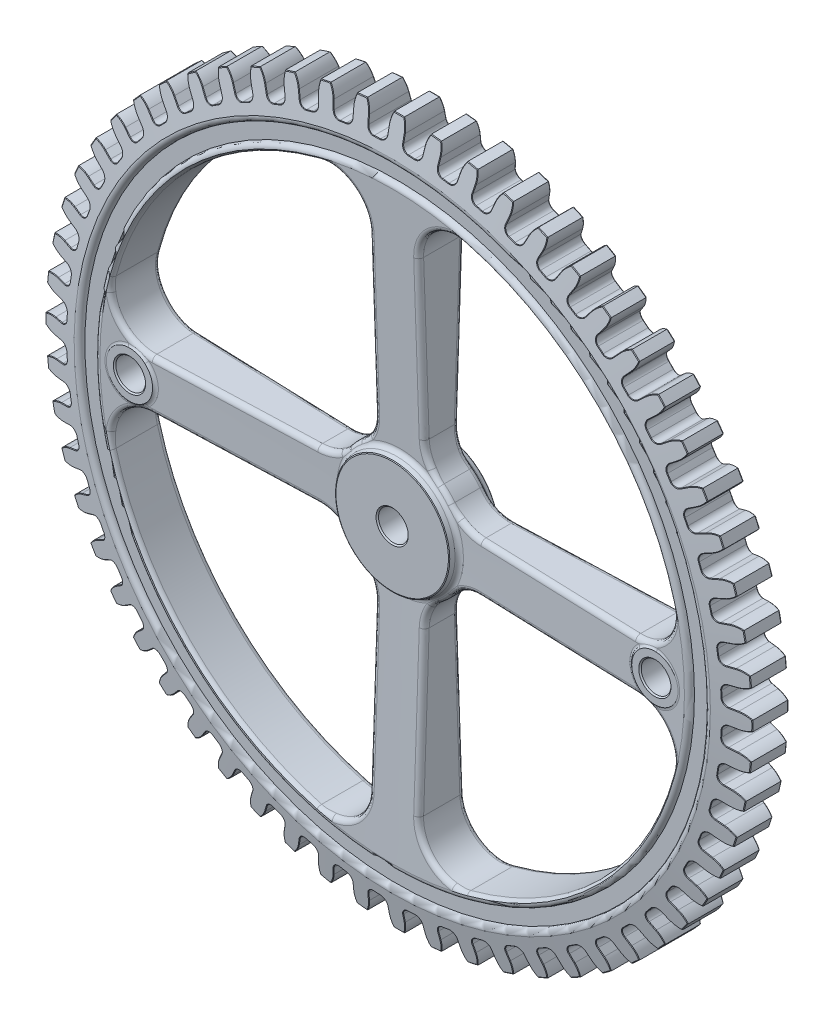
SolidWorks part; units mm, degrees
ref_plane "Спереди" through (0, 0, 0) normal (0, 0, 1) x (1, 0, 0)
ref_plane "Сверху" through (0, 0, 0) normal (0, 1, 0) x (1, 0, 0)
ref_plane "Справа" through (0, 0, 0) normal (1, 0, 0) x (0, 0, -1)
sketch "Эскиз2" plane through (0, 0, 0) normal (1, 0, 0) x (0, 0, -1)
  line L0 (-9.4803, 0) -> (8.8412, 0) construction
  line L1 (5, 3) -> (-5, 3)
  line L2 (5, 3) -> (5, 11.5)
  line L3 (3.6, 71.3) -> (-3.6, 71.3)
  line L4 (0, 0) -> (0, 71.3) construction
  line L5 (4, 63) -> (4, 60)
  line L6 (5, 11.5) -> (5, 38.75) construction
  line L7 (3.6, 71.3) -> (4.9816, 64.1908)
  line L8 (5, 11.5) -> (4.0932, 11.7772)
  line L9 (4.9994, 58.9651) -> (3.3862, 12.7684)
  line L10 (-5, 3) -> (-5, 11.5)
  line L11 (-5, 11.5) -> (-4.0932, 11.7772)
  line L12 (-4.9994, 58.9651) -> (-3.3862, 12.7684)
  line L13 (-4, 63) -> (-4, 60)
  line L14 (-3.6, 71.3) -> (-4.9816, 64.1908)
  arc A0 (4, 63) -> (4.9816, 64.1908) centre (4, 64) ccw
  arc A1 (4.9994, 58.9651) -> (4, 60) centre (4, 59) ccw
  arc A2 (3.3862, 12.7684) -> (4.0932, 11.7772) centre (4.3856, 12.7335) ccw
  arc A3 (-3.3862, 12.7684) -> (-4.0932, 11.7772) centre (-4.3856, 12.7335) cw
  arc A4 (-4.9994, 58.9651) -> (-4, 60) centre (-4, 59) cw
  arc A5 (-4, 63) -> (-4.9816, 64.1908) centre (-4, 64) cw
  point P19 (0, 3)
  dimension "D8" = 2
  dimension "D1" = 8.3
  dimension "D2" = 71.3
  dimension "D3" = 5
  dimension "D4" = 3
  dimension "D5" = 3.6
  dimension "D6" = 3
  dimension "D7" = 11.5
  dimension "D9" = 4
  dimension "D10" = 17
  dimension "D11" = 2
revolve "Повернуть1" add sketch "Эскиз2" angle 360 about L0
sketch "Эскиз4" plane through (0, 0, 0) normal (0, 0, 1) x (1, 0, 0)
  line L0 (0, 77.9843) -> (0, -81.6368) construction
  line L1 (-86.0797, 0) -> (81.9993, 0) construction
  line L2 (5, 48.7981) -> (5, 16.4924)
  line L3 (16.4924, 5) -> (48.7981, 5)
  line L4 (48.7981, -5) -> (16.4924, -5)
  line L5 (5, -16.4924) -> (5, -48.7981)
  line L6 (-5, -48.7981) -> (-5, -16.4924)
  line L7 (-16.4924, -5) -> (-48.7981, -5)
  line L8 (-48.7981, 5) -> (-16.4924, 5)
  line L9 (-5, 16.4924) -> (-5, 48.7981)
  arc A0 (10.2096, 8.0476) -> (8.0476, 10.2096) centre (0, 0) ccw
  arc A1 (56.5284, 15.0594) -> (15.0594, 56.5284) centre (0, 0) ccw
  arc A2 (15.0594, 56.5284) -> (5, 48.7981) centre (13, 48.7981) ccw
  arc A3 (48.7981, 5) -> (56.5284, 15.0594) centre (48.7981, 13) ccw
  arc A4 (5, 16.4924) -> (8.0476, 10.2096) centre (13, 16.4924) ccw
  arc A5 (10.2096, 8.0476) -> (16.4924, 5) centre (16.4924, 13) ccw
  arc A6 (8.0476, -10.2096) -> (10.2096, -8.0476) centre (0, 0) ccw
  arc A7 (15.0594, -56.5284) -> (56.5284, -15.0594) centre (0, 0) ccw
  arc A8 (56.5284, -15.0594) -> (48.7981, -5) centre (48.7981, -13) ccw
  arc A9 (5, -48.7981) -> (15.0594, -56.5284) centre (13, -48.7981) ccw
  arc A10 (16.4924, -5) -> (10.2096, -8.0476) centre (16.4924, -13) ccw
  arc A11 (8.0476, -10.2096) -> (5, -16.4924) centre (13, -16.4924) ccw
  arc A12 (-10.2096, -8.0476) -> (-8.0476, -10.2096) centre (0, 0) ccw
  arc A13 (-56.5284, -15.0594) -> (-15.0594, -56.5284) centre (0, 0) ccw
  arc A14 (-15.0594, -56.5284) -> (-5, -48.7981) centre (-13, -48.7981) ccw
  arc A15 (-48.7981, -5) -> (-56.5284, -15.0594) centre (-48.7981, -13) ccw
  arc A16 (-5, -16.4924) -> (-8.0476, -10.2096) centre (-13, -16.4924) ccw
  arc A17 (-10.2096, -8.0476) -> (-16.4924, -5) centre (-16.4924, -13) ccw
  arc A18 (-8.0476, 10.2096) -> (-10.2096, 8.0476) centre (0, 0) ccw
  arc A19 (-15.0594, 56.5284) -> (-56.5284, 15.0594) centre (0, 0) ccw
  arc A20 (-56.5284, 15.0594) -> (-48.7981, 5) centre (-48.7981, 13) ccw
  arc A21 (-5, 48.7981) -> (-15.0594, 56.5284) centre (-13, 48.7981) ccw
  arc A22 (-16.4924, 5) -> (-10.2096, 8.0476) centre (-16.4924, 13) ccw
  arc A23 (-8.0476, 10.2096) -> (-5, 16.4924) centre (-13, 16.4924) ccw
  dimension "D3" = 26
  dimension "D4" = 117
  dimension "D5" = 16
  dimension "D1" = 5
  dimension "D2" = 5
  dimension "D7" = 10
  dimension "D6" = 4
extrude "Вырез-Вытянуть1" cut sketch "Эскиз4" against normal mid plane 10
fillet "Скругление1" radius 1 56 edges at (12.2001, 6.249, -3.419) (9.1924, 9.1924, -3.3943) (5.4509, 13.8447, -3.4599) (7.5393, 54.6445, -4.8666) (55.5841, 8.7633, -4.9053) (54.6445, -7.5393, -4.8666) (8.7633, -55.5841, -4.9053) (6.249, -12.2001, -3.419) (9.1924, -9.1924, -3.3943) (13.8447, -5.4509, -3.4599) (-12.2001, -6.249, -3.419) (-9.1924, -9.1924, -3.3943) (-5.4509, -13.8447, -3.4599) (-7.5393, -54.6445, -4.8666) (-55.5841, -8.7633, -4.9053) (-54.6445, 7.5393, -4.8666) (-8.7633, 55.5841, -4.9053) (-6.249, 12.2001, -3.419) (-9.1924, 9.1924, -3.3943) (-13.8447, 5.4509, -3.4599) (7.5393, -54.6445, 4.8666) (55.5841, -8.7633, 4.9053) (12.2001, -6.249, 3.419) (9.1924, -9.1924, 3.3943) (5.4509, -13.8447, 3.4599) (-54.6445, -7.5393, 4.8666) (-8.7633, -55.5841, 4.9053) (-6.249, -12.2001, 3.419) (-9.1924, -9.1924, 3.3943) (-13.8447, -5.4509, 3.4599) (-7.5393, 54.6445, 4.8666) (-55.5841, 8.7633, 4.9053) (-12.2001, 6.249, 3.419) (-9.1924, 9.1924, 3.3943) (-5.4509, 13.8447, 3.4599) (6.249, 12.2001, 3.419) (9.1924, 9.1924, 3.3943) (13.8447, 5.4509, 3.4599) (54.6445, 7.5393, 4.8666) (8.7633, 55.5841, 4.9053)
sketch "Эскиз5" plane through (0, 0, 0) normal (0, 0, 1) x (1, 0, 0)
  line L0 (0, 93.6984) -> (0, 0) construction
  line L1 (0, 0) -> (3.6112, 68.9054) construction
  line L2 (-1.6, 68.9054) -> (-1.6, 67.3339)
  line L3 (1.6, 68.9054) -> (1.6, 67.3339)
  line L4 (5.6113, 68.6952) -> (5.4471, 67.1322)
  line L5 (8.7938, 68.3607) -> (8.6295, 66.7978)
  line L6 (12.7612, 67.7323) -> (12.4345, 66.1951)
  line L7 (15.8913, 67.067) -> (15.5645, 65.5298)
  line L8 (19.7713, 66.0274) -> (19.2856, 64.5327)
  line L9 (22.8146, 65.0385) -> (22.329, 63.5439)
  line L10 (26.5647, 63.599) -> (25.9255, 62.1633)
  line L11 (29.488, 62.2975) -> (28.8488, 60.8618)
  line L12 (33.0671, 60.4739) -> (32.2813, 59.1128)
  line L13 (35.8384, 58.8739) -> (35.0526, 57.5128)
  line L14 (39.2072, 56.6861) -> (38.2834, 55.4147)
  line L15 (41.796, 54.8052) -> (40.8723, 53.5338)
  line L16 (44.9177, 52.2773) -> (43.8661, 51.1094)
  line L17 (47.2958, 50.1361) -> (46.2442, 48.9682)
  line L18 (50.1361, 47.2958) -> (48.9682, 46.2442)
  line L19 (52.2773, 44.9177) -> (51.1094, 43.8661)
  line L20 (54.8052, 41.796) -> (53.5338, 40.8723)
  line L21 (56.6861, 39.2072) -> (55.4147, 38.2834)
  line L22 (58.8739, 35.8384) -> (57.5128, 35.0526)
  line L23 (60.4739, 33.0671) -> (59.1128, 32.2813)
  line L24 (62.2975, 29.488) -> (60.8618, 28.8488)
  line L25 (63.599, 26.5647) -> (62.1633, 25.9255)
  line L26 (65.0385, 22.8146) -> (63.5439, 22.329)
  line L27 (66.0274, 19.7713) -> (64.5327, 19.2856)
  line L28 (67.067, 15.8913) -> (65.5298, 15.5645)
  line L29 (67.7323, 12.7612) -> (66.1951, 12.4345)
  line L30 (68.3607, 8.7938) -> (66.7978, 8.6295)
  line L31 (68.6952, 5.6113) -> (67.1322, 5.4471)
  line L32 (68.9054, 1.6) -> (67.3339, 1.6)
  line L33 (68.9054, -1.6) -> (67.3339, -1.6)
  line L34 (68.6952, -5.6113) -> (67.1322, -5.4471)
  line L35 (68.3607, -8.7938) -> (66.7978, -8.6295)
  line L36 (67.7323, -12.7612) -> (66.1951, -12.4345)
  line L37 (67.067, -15.8913) -> (65.5298, -15.5645)
  line L38 (66.0274, -19.7713) -> (64.5327, -19.2856)
  line L39 (65.0385, -22.8146) -> (63.5439, -22.329)
  line L40 (63.599, -26.5647) -> (62.1633, -25.9255)
  line L41 (62.2975, -29.488) -> (60.8618, -28.8488)
  line L42 (60.4739, -33.0671) -> (59.1128, -32.2813)
  line L43 (58.8739, -35.8384) -> (57.5128, -35.0526)
  line L44 (56.6861, -39.2072) -> (55.4147, -38.2834)
  line L45 (54.8052, -41.796) -> (53.5338, -40.8723)
  line L46 (52.2773, -44.9177) -> (51.1094, -43.8661)
  line L47 (50.1361, -47.2958) -> (48.9682, -46.2442)
  line L48 (47.2958, -50.1361) -> (46.2442, -48.9682)
  line L49 (44.9177, -52.2773) -> (43.8661, -51.1094)
  line L50 (41.796, -54.8052) -> (40.8723, -53.5338)
  line L51 (39.2072, -56.6861) -> (38.2834, -55.4147)
  line L52 (35.8384, -58.8739) -> (35.0526, -57.5128)
  line L53 (33.0671, -60.4739) -> (32.2813, -59.1128)
  line L54 (29.488, -62.2975) -> (28.8488, -60.8618)
  line L55 (26.5647, -63.599) -> (25.9255, -62.1633)
  line L56 (22.8146, -65.0385) -> (22.329, -63.5439)
  line L57 (19.7713, -66.0274) -> (19.2856, -64.5327)
  line L58 (15.8913, -67.067) -> (15.5645, -65.5298)
  line L59 (12.7612, -67.7323) -> (12.4345, -66.1951)
  line L60 (8.7938, -68.3607) -> (8.6295, -66.7978)
  line L61 (5.6113, -68.6952) -> (5.4471, -67.1322)
  line L62 (1.6, -68.9054) -> (1.6, -67.3339)
  line L63 (-1.6, -68.9054) -> (-1.6, -67.3339)
  line L64 (-5.6113, -68.6952) -> (-5.4471, -67.1322)
  line L65 (-8.7938, -68.3607) -> (-8.6295, -66.7978)
  line L66 (-12.7612, -67.7323) -> (-12.4345, -66.1951)
  line L67 (-15.8913, -67.067) -> (-15.5645, -65.5298)
  line L68 (-19.7713, -66.0274) -> (-19.2856, -64.5327)
  line L69 (-22.8146, -65.0385) -> (-22.329, -63.5439)
  line L70 (-26.5647, -63.599) -> (-25.9255, -62.1633)
  line L71 (-29.488, -62.2975) -> (-28.8488, -60.8618)
  line L72 (-33.0671, -60.4739) -> (-32.2813, -59.1128)
  line L73 (-35.8384, -58.8739) -> (-35.0526, -57.5128)
  line L74 (-39.2072, -56.6861) -> (-38.2834, -55.4147)
  line L75 (-41.796, -54.8052) -> (-40.8723, -53.5338)
  line L76 (-44.9177, -52.2773) -> (-43.8661, -51.1094)
  line L77 (-47.2958, -50.1361) -> (-46.2442, -48.9682)
  line L78 (-50.1361, -47.2958) -> (-48.9682, -46.2442)
  line L79 (-52.2773, -44.9177) -> (-51.1094, -43.8661)
  line L80 (-54.8052, -41.796) -> (-53.5338, -40.8723)
  line L81 (-56.6861, -39.2072) -> (-55.4147, -38.2834)
  line L82 (-58.8739, -35.8384) -> (-57.5128, -35.0526)
  line L83 (-60.4739, -33.0671) -> (-59.1128, -32.2813)
  line L84 (-62.2975, -29.488) -> (-60.8618, -28.8488)
  line L85 (-63.599, -26.5647) -> (-62.1633, -25.9255)
  line L86 (-65.0385, -22.8146) -> (-63.5439, -22.329)
  line L87 (-66.0274, -19.7713) -> (-64.5327, -19.2856)
  line L88 (-67.067, -15.8913) -> (-65.5298, -15.5645)
  line L89 (-67.7323, -12.7612) -> (-66.1951, -12.4345)
  line L90 (-68.3607, -8.7938) -> (-66.7978, -8.6295)
  line L91 (-68.6952, -5.6113) -> (-67.1322, -5.4471)
  line L92 (-68.9054, -1.6) -> (-67.3339, -1.6)
  line L93 (-68.9054, 1.6) -> (-67.3339, 1.6)
  line L94 (-68.6952, 5.6113) -> (-67.1322, 5.4471)
  line L95 (-68.3607, 8.7938) -> (-66.7978, 8.6295)
  line L96 (-67.7323, 12.7612) -> (-66.1951, 12.4345)
  line L97 (-67.067, 15.8913) -> (-65.5298, 15.5645)
  line L98 (-66.0274, 19.7713) -> (-64.5327, 19.2856)
  line L99 (-65.0385, 22.8146) -> (-63.5439, 22.329)
  line L100 (-63.599, 26.5647) -> (-62.1633, 25.9255)
  line L101 (-62.2975, 29.488) -> (-60.8618, 28.8488)
  line L102 (-60.4739, 33.0671) -> (-59.1128, 32.2813)
  line L103 (-58.8739, 35.8384) -> (-57.5128, 35.0526)
  line L104 (-56.6861, 39.2072) -> (-55.4147, 38.2834)
  line L105 (-54.8052, 41.796) -> (-53.5338, 40.8723)
  line L106 (-52.2773, 44.9177) -> (-51.1094, 43.8661)
  line L107 (-50.1361, 47.2958) -> (-48.9682, 46.2442)
  line L108 (-47.2958, 50.1361) -> (-46.2442, 48.9682)
  line L109 (-44.9177, 52.2773) -> (-43.8661, 51.1094)
  line L110 (-41.796, 54.8052) -> (-40.8723, 53.5338)
  line L111 (-39.2072, 56.6861) -> (-38.2834, 55.4147)
  line L112 (-35.8384, 58.8739) -> (-35.0526, 57.5128)
  line L113 (-33.0671, 60.4739) -> (-32.2813, 59.1128)
  line L114 (-29.488, 62.2975) -> (-28.8488, 60.8618)
  line L115 (-26.5647, 63.599) -> (-25.9255, 62.1633)
  line L116 (-22.8146, 65.0385) -> (-22.329, 63.5439)
  line L117 (-19.7713, 66.0274) -> (-19.2856, 64.5327)
  line L118 (-15.8913, 67.067) -> (-15.5645, 65.5298)
  line L119 (-12.7612, 67.7323) -> (-12.4345, 66.1951)
  line L120 (-8.7938, 68.3607) -> (-8.6295, 66.7978)
  line L121 (-5.6113, 68.6952) -> (-5.4471, 67.1322)
  circle A0 centre (0, 0) radius 69 construction
  arc A1 (-9.7062, 65.4088) -> (-10.9813, 65.2068) centre (0, 0) ccw
  arc A2 (-1.021, 71.2927) -> (-1.6, 68.9054) centre (3.6112, 68.9054) ccw
  circle A3 centre (0, 0) radius 71.3 construction
  arc A4 (1.021, 71.2927) -> (-1.021, 71.2927) centre (0, 0) ccw
  arc A5 (1.021, 71.2927) -> (1.6, 68.9054) centre (-3.6112, 68.9054) cw
  arc A6 (6.4367, 71.0089) -> (5.6113, 68.6952) centre (10.794, 68.1505) ccw
  arc A7 (8.4676, 70.7954) -> (6.4367, 71.0089) centre (0, 0) ccw
  arc A8 (8.4676, 70.7954) -> (8.7938, 68.3607) centre (3.6112, 68.9054) cw
  arc A9 (13.8239, 69.9471) -> (12.7612, 67.7323) centre (17.8585, 66.6489) ccw
  arc A10 (15.8213, 69.5225) -> (13.8239, 69.9471) centre (0, 0) ccw
  arc A11 (15.8213, 69.5225) -> (15.8913, 67.067) centre (10.794, 68.1505) cw
  arc A12 (21.0596, 68.1189) -> (19.7713, 66.0274) centre (24.7274, 64.417) ccw
  arc A13 (23.0017, 67.4879) -> (21.0596, 68.1189) centre (0, 0) ccw
  arc A14 (23.0017, 67.4879) -> (22.8146, 65.0385) centre (17.8585, 66.6489) cw
  arc A15 (28.0646, 65.5444) -> (26.5647, 63.599) centre (31.3253, 61.4795) ccw
  arc A16 (29.9301, 64.7138) -> (28.0646, 65.5444) centre (0, 0) ccw
  arc A17 (29.9301, 64.7138) -> (29.488, 62.2975) centre (24.7274, 64.417) cw
  arc A18 (34.7621, 62.2518) -> (33.0671, 60.4739) centre (37.5801, 57.8683) ccw
  arc A19 (36.5306, 61.2308) -> (34.7621, 62.2518) centre (0, 0) ccw
  arc A20 (36.5306, 61.2308) -> (35.8384, 58.8739) centre (31.3253, 61.4795) cw
  arc A21 (41.0788, 58.2771) -> (39.2072, 56.6861) centre (43.4231, 53.6231) ccw
  arc A22 (42.7308, 57.0768) -> (41.0788, 58.2771) centre (0, 0) ccw
  arc A23 (42.7308, 57.0768) -> (41.796, 54.8052) centre (37.5801, 57.8683) cw
  arc A24 (46.9453, 53.664) -> (44.9177, 52.2773) centre (48.7904, 48.7904) ccw
  arc A25 (48.4629, 52.2976) -> (46.9453, 53.664) centre (0, 0) ccw
  arc A26 (48.4629, 52.2976) -> (47.2958, 50.1361) centre (43.4231, 53.6231) cw
  arc A27 (52.2976, 48.4629) -> (50.1361, 47.2958) centre (53.6231, 43.4231) ccw
  arc A28 (53.664, 46.9453) -> (52.2976, 48.4629) centre (0, 0) ccw
  arc A29 (53.664, 46.9453) -> (52.2773, 44.9177) centre (48.7904, 48.7904) cw
  arc A30 (57.0768, 42.7308) -> (54.8052, 41.796) centre (57.8683, 37.5801) ccw
  arc A31 (58.2771, 41.0788) -> (57.0768, 42.7308) centre (0, 0) ccw
  arc A32 (58.2771, 41.0788) -> (56.6861, 39.2072) centre (53.6231, 43.4231) cw
  arc A33 (61.2308, 36.5306) -> (58.8739, 35.8384) centre (61.4795, 31.3253) ccw
  arc A34 (62.2518, 34.7621) -> (61.2308, 36.5306) centre (0, 0) ccw
  arc A35 (62.2518, 34.7621) -> (60.4739, 33.0671) centre (57.8683, 37.5801) cw
  arc A36 (64.7138, 29.9301) -> (62.2975, 29.488) centre (64.417, 24.7274) ccw
  arc A37 (65.5444, 28.0646) -> (64.7138, 29.9301) centre (0, 0) ccw
  arc A38 (65.5444, 28.0646) -> (63.599, 26.5647) centre (61.4795, 31.3253) cw
  arc A39 (67.4879, 23.0017) -> (65.0385, 22.8146) centre (66.6489, 17.8585) ccw
  arc A40 (68.1189, 21.0596) -> (67.4879, 23.0017) centre (0, 0) ccw
  arc A41 (68.1189, 21.0596) -> (66.0274, 19.7713) centre (64.417, 24.7274) cw
  arc A42 (69.5225, 15.8213) -> (67.067, 15.8913) centre (68.1505, 10.794) ccw
  arc A43 (69.9471, 13.8239) -> (69.5225, 15.8213) centre (0, 0) ccw
  arc A44 (69.9471, 13.8239) -> (67.7323, 12.7612) centre (66.6489, 17.8585) cw
  arc A45 (70.7954, 8.4676) -> (68.3607, 8.7938) centre (68.9054, 3.6112) ccw
  arc A46 (71.0089, 6.4367) -> (70.7954, 8.4676) centre (0, 0) ccw
  arc A47 (71.0089, 6.4367) -> (68.6952, 5.6113) centre (68.1505, 10.794) cw
  arc A48 (71.2927, 1.021) -> (68.9054, 1.6) centre (68.9054, -3.6112) ccw
  arc A49 (71.2927, -1.021) -> (71.2927, 1.021) centre (0, 0) ccw
  arc A50 (71.2927, -1.021) -> (68.9054, -1.6) centre (68.9054, 3.6112) cw
  arc A51 (71.0089, -6.4367) -> (68.6952, -5.6113) centre (68.1505, -10.794) ccw
  arc A52 (70.7954, -8.4676) -> (71.0089, -6.4367) centre (0, 0) ccw
  arc A53 (70.7954, -8.4676) -> (68.3607, -8.7938) centre (68.9054, -3.6112) cw
  arc A54 (69.9471, -13.8239) -> (67.7323, -12.7612) centre (66.6489, -17.8585) ccw
  arc A55 (69.5225, -15.8213) -> (69.9471, -13.8239) centre (0, 0) ccw
  arc A56 (69.5225, -15.8213) -> (67.067, -15.8913) centre (68.1505, -10.794) cw
  arc A57 (68.1189, -21.0596) -> (66.0274, -19.7713) centre (64.417, -24.7274) ccw
  arc A58 (67.4879, -23.0017) -> (68.1189, -21.0596) centre (0, 0) ccw
  arc A59 (67.4879, -23.0017) -> (65.0385, -22.8146) centre (66.6489, -17.8585) cw
  arc A60 (65.5444, -28.0646) -> (63.599, -26.5647) centre (61.4795, -31.3253) ccw
  arc A61 (64.7138, -29.9301) -> (65.5444, -28.0646) centre (0, 0) ccw
  arc A62 (64.7138, -29.9301) -> (62.2975, -29.488) centre (64.417, -24.7274) cw
  arc A63 (62.2518, -34.7621) -> (60.4739, -33.0671) centre (57.8683, -37.5801) ccw
  arc A64 (61.2308, -36.5306) -> (62.2518, -34.7621) centre (0, 0) ccw
  arc A65 (61.2308, -36.5306) -> (58.8739, -35.8384) centre (61.4795, -31.3253) cw
  arc A66 (58.2771, -41.0788) -> (56.6861, -39.2072) centre (53.6231, -43.4231) ccw
  arc A67 (57.0768, -42.7308) -> (58.2771, -41.0788) centre (0, 0) ccw
  arc A68 (57.0768, -42.7308) -> (54.8052, -41.796) centre (57.8683, -37.5801) cw
  arc A69 (53.664, -46.9453) -> (52.2773, -44.9177) centre (48.7904, -48.7904) ccw
  arc A70 (52.2976, -48.4629) -> (53.664, -46.9453) centre (0, 0) ccw
  arc A71 (52.2976, -48.4629) -> (50.1361, -47.2958) centre (53.6231, -43.4231) cw
  arc A72 (48.4629, -52.2976) -> (47.2958, -50.1361) centre (43.4231, -53.6231) ccw
  arc A73 (46.9453, -53.664) -> (48.4629, -52.2976) centre (0, 0) ccw
  arc A74 (46.9453, -53.664) -> (44.9177, -52.2773) centre (48.7904, -48.7904) cw
  arc A75 (42.7308, -57.0768) -> (41.796, -54.8052) centre (37.5801, -57.8683) ccw
  arc A76 (41.0788, -58.2771) -> (42.7308, -57.0768) centre (0, 0) ccw
  arc A77 (41.0788, -58.2771) -> (39.2072, -56.6861) centre (43.4231, -53.6231) cw
  arc A78 (36.5306, -61.2308) -> (35.8384, -58.8739) centre (31.3253, -61.4795) ccw
  arc A79 (34.7621, -62.2518) -> (36.5306, -61.2308) centre (0, 0) ccw
  arc A80 (34.7621, -62.2518) -> (33.0671, -60.4739) centre (37.5801, -57.8683) cw
  arc A81 (29.9301, -64.7138) -> (29.488, -62.2975) centre (24.7274, -64.417) ccw
  arc A82 (28.0646, -65.5444) -> (29.9301, -64.7138) centre (0, 0) ccw
  arc A83 (28.0646, -65.5444) -> (26.5647, -63.599) centre (31.3253, -61.4795) cw
  arc A84 (23.0017, -67.4879) -> (22.8146, -65.0385) centre (17.8585, -66.6489) ccw
  arc A85 (21.0596, -68.1189) -> (23.0017, -67.4879) centre (0, 0) ccw
  arc A86 (21.0596, -68.1189) -> (19.7713, -66.0274) centre (24.7274, -64.417) cw
  arc A87 (15.8213, -69.5225) -> (15.8913, -67.067) centre (10.794, -68.1505) ccw
  arc A88 (13.8239, -69.9471) -> (15.8213, -69.5225) centre (0, 0) ccw
  arc A89 (13.8239, -69.9471) -> (12.7612, -67.7323) centre (17.8585, -66.6489) cw
  arc A90 (8.4676, -70.7954) -> (8.7938, -68.3607) centre (3.6112, -68.9054) ccw
  arc A91 (6.4367, -71.0089) -> (8.4676, -70.7954) centre (0, 0) ccw
  arc A92 (6.4367, -71.0089) -> (5.6113, -68.6952) centre (10.794, -68.1505) cw
  arc A93 (1.021, -71.2927) -> (1.6, -68.9054) centre (-3.6112, -68.9054) ccw
  arc A94 (-1.021, -71.2927) -> (1.021, -71.2927) centre (0, 0) ccw
  arc A95 (-1.021, -71.2927) -> (-1.6, -68.9054) centre (3.6112, -68.9054) cw
  arc A96 (-6.4367, -71.0089) -> (-5.6113, -68.6952) centre (-10.794, -68.1505) ccw
  arc A97 (-8.4676, -70.7954) -> (-6.4367, -71.0089) centre (0, 0) ccw
  arc A98 (-8.4676, -70.7954) -> (-8.7938, -68.3607) centre (-3.6112, -68.9054) cw
  arc A99 (-13.8239, -69.9471) -> (-12.7612, -67.7323) centre (-17.8585, -66.6489) ccw
  arc A100 (-15.8213, -69.5225) -> (-13.8239, -69.9471) centre (0, 0) ccw
  arc A101 (-15.8213, -69.5225) -> (-15.8913, -67.067) centre (-10.794, -68.1505) cw
  arc A102 (-21.0596, -68.1189) -> (-19.7713, -66.0274) centre (-24.7274, -64.417) ccw
  arc A103 (-23.0017, -67.4879) -> (-21.0596, -68.1189) centre (0, 0) ccw
  arc A104 (-23.0017, -67.4879) -> (-22.8146, -65.0385) centre (-17.8585, -66.6489) cw
  arc A105 (-28.0646, -65.5444) -> (-26.5647, -63.599) centre (-31.3253, -61.4795) ccw
  arc A106 (-29.9301, -64.7138) -> (-28.0646, -65.5444) centre (0, 0) ccw
  arc A107 (-29.9301, -64.7138) -> (-29.488, -62.2975) centre (-24.7274, -64.417) cw
  arc A108 (-34.7621, -62.2518) -> (-33.0671, -60.4739) centre (-37.5801, -57.8683) ccw
  arc A109 (-36.5306, -61.2308) -> (-34.7621, -62.2518) centre (0, 0) ccw
  arc A110 (-36.5306, -61.2308) -> (-35.8384, -58.8739) centre (-31.3253, -61.4795) cw
  arc A111 (-41.0788, -58.2771) -> (-39.2072, -56.6861) centre (-43.4231, -53.6231) ccw
  arc A112 (-42.7308, -57.0768) -> (-41.0788, -58.2771) centre (0, 0) ccw
  arc A113 (-42.7308, -57.0768) -> (-41.796, -54.8052) centre (-37.5801, -57.8683) cw
  arc A114 (-46.9453, -53.664) -> (-44.9177, -52.2773) centre (-48.7904, -48.7904) ccw
  arc A115 (-48.4629, -52.2976) -> (-46.9453, -53.664) centre (0, 0) ccw
  arc A116 (-48.4629, -52.2976) -> (-47.2958, -50.1361) centre (-43.4231, -53.6231) cw
  arc A117 (-52.2976, -48.4629) -> (-50.1361, -47.2958) centre (-53.6231, -43.4231) ccw
  arc A118 (-53.664, -46.9453) -> (-52.2976, -48.4629) centre (0, 0) ccw
  arc A119 (-53.664, -46.9453) -> (-52.2773, -44.9177) centre (-48.7904, -48.7904) cw
  arc A120 (-57.0768, -42.7308) -> (-54.8052, -41.796) centre (-57.8683, -37.5801) ccw
  arc A121 (-58.2771, -41.0788) -> (-57.0768, -42.7308) centre (0, 0) ccw
  arc A122 (-58.2771, -41.0788) -> (-56.6861, -39.2072) centre (-53.6231, -43.4231) cw
  arc A123 (-61.2308, -36.5306) -> (-58.8739, -35.8384) centre (-61.4795, -31.3253) ccw
  arc A124 (-62.2518, -34.7621) -> (-61.2308, -36.5306) centre (0, 0) ccw
  arc A125 (-62.2518, -34.7621) -> (-60.4739, -33.0671) centre (-57.8683, -37.5801) cw
  arc A126 (-64.7138, -29.9301) -> (-62.2975, -29.488) centre (-64.417, -24.7274) ccw
  arc A127 (-65.5444, -28.0646) -> (-64.7138, -29.9301) centre (0, 0) ccw
  arc A128 (-65.5444, -28.0646) -> (-63.599, -26.5647) centre (-61.4795, -31.3253) cw
  arc A129 (-67.4879, -23.0017) -> (-65.0385, -22.8146) centre (-66.6489, -17.8585) ccw
  arc A130 (-68.1189, -21.0596) -> (-67.4879, -23.0017) centre (0, 0) ccw
  arc A131 (-68.1189, -21.0596) -> (-66.0274, -19.7713) centre (-64.417, -24.7274) cw
  arc A132 (-69.5225, -15.8213) -> (-67.067, -15.8913) centre (-68.1505, -10.794) ccw
  arc A133 (-69.9471, -13.8239) -> (-69.5225, -15.8213) centre (0, 0) ccw
  arc A134 (-69.9471, -13.8239) -> (-67.7323, -12.7612) centre (-66.6489, -17.8585) cw
  arc A135 (-70.7954, -8.4676) -> (-68.3607, -8.7938) centre (-68.9054, -3.6112) ccw
  arc A136 (-71.0089, -6.4367) -> (-70.7954, -8.4676) centre (0, 0) ccw
  arc A137 (-71.0089, -6.4367) -> (-68.6952, -5.6113) centre (-68.1505, -10.794) cw
  arc A138 (-71.2927, -1.021) -> (-68.9054, -1.6) centre (-68.9054, 3.6112) ccw
  arc A139 (-71.2927, 1.021) -> (-71.2927, -1.021) centre (0, 0) ccw
  arc A140 (-71.2927, 1.021) -> (-68.9054, 1.6) centre (-68.9054, -3.6112) cw
  arc A141 (-71.0089, 6.4367) -> (-68.6952, 5.6113) centre (-68.1505, 10.794) ccw
  arc A142 (-70.7954, 8.4676) -> (-71.0089, 6.4367) centre (0, 0) ccw
  arc A143 (-70.7954, 8.4676) -> (-68.3607, 8.7938) centre (-68.9054, 3.6112) cw
  arc A144 (-69.9471, 13.8239) -> (-67.7323, 12.7612) centre (-66.6489, 17.8585) ccw
  arc A145 (-69.5225, 15.8213) -> (-69.9471, 13.8239) centre (0, 0) ccw
  arc A146 (-69.5225, 15.8213) -> (-67.067, 15.8913) centre (-68.1505, 10.794) cw
  arc A147 (-68.1189, 21.0596) -> (-66.0274, 19.7713) centre (-64.417, 24.7274) ccw
  arc A148 (-67.4879, 23.0017) -> (-68.1189, 21.0596) centre (0, 0) ccw
  arc A149 (-67.4879, 23.0017) -> (-65.0385, 22.8146) centre (-66.6489, 17.8585) cw
  arc A150 (-65.5444, 28.0646) -> (-63.599, 26.5647) centre (-61.4795, 31.3253) ccw
  arc A151 (-64.7138, 29.9301) -> (-65.5444, 28.0646) centre (0, 0) ccw
  arc A152 (-64.7138, 29.9301) -> (-62.2975, 29.488) centre (-64.417, 24.7274) cw
  arc A153 (-62.2518, 34.7621) -> (-60.4739, 33.0671) centre (-57.8683, 37.5801) ccw
  arc A154 (-61.2308, 36.5306) -> (-62.2518, 34.7621) centre (0, 0) ccw
  arc A155 (-61.2308, 36.5306) -> (-58.8739, 35.8384) centre (-61.4795, 31.3253) cw
  arc A156 (-58.2771, 41.0788) -> (-56.6861, 39.2072) centre (-53.6231, 43.4231) ccw
  arc A157 (-57.0768, 42.7308) -> (-58.2771, 41.0788) centre (0, 0) ccw
  arc A158 (-57.0768, 42.7308) -> (-54.8052, 41.796) centre (-57.8683, 37.5801) cw
  arc A159 (-53.664, 46.9453) -> (-52.2773, 44.9177) centre (-48.7904, 48.7904) ccw
  arc A160 (-52.2976, 48.4629) -> (-53.664, 46.9453) centre (0, 0) ccw
  arc A161 (-52.2976, 48.4629) -> (-50.1361, 47.2958) centre (-53.6231, 43.4231) cw
  arc A162 (-48.4629, 52.2976) -> (-47.2958, 50.1361) centre (-43.4231, 53.6231) ccw
  arc A163 (-46.9453, 53.664) -> (-48.4629, 52.2976) centre (0, 0) ccw
  arc A164 (-46.9453, 53.664) -> (-44.9177, 52.2773) centre (-48.7904, 48.7904) cw
  arc A165 (-42.7308, 57.0768) -> (-41.796, 54.8052) centre (-37.5801, 57.8683) ccw
  arc A166 (-41.0788, 58.2771) -> (-42.7308, 57.0768) centre (0, 0) ccw
  arc A167 (-41.0788, 58.2771) -> (-39.2072, 56.6861) centre (-43.4231, 53.6231) cw
  arc A168 (-36.5306, 61.2308) -> (-35.8384, 58.8739) centre (-31.3253, 61.4795) ccw
  arc A169 (-34.7621, 62.2518) -> (-36.5306, 61.2308) centre (0, 0) ccw
  arc A170 (-34.7621, 62.2518) -> (-33.0671, 60.4739) centre (-37.5801, 57.8683) cw
  arc A171 (-29.9301, 64.7138) -> (-29.488, 62.2975) centre (-24.7274, 64.417) ccw
  arc A172 (-28.0646, 65.5444) -> (-29.9301, 64.7138) centre (0, 0) ccw
  arc A173 (-28.0646, 65.5444) -> (-26.5647, 63.599) centre (-31.3253, 61.4795) cw
  arc A174 (-23.0017, 67.4879) -> (-22.8146, 65.0385) centre (-17.8585, 66.6489) ccw
  arc A175 (-21.0596, 68.1189) -> (-23.0017, 67.4879) centre (0, 0) ccw
  arc A176 (-21.0596, 68.1189) -> (-19.7713, 66.0274) centre (-24.7274, 64.417) cw
  arc A177 (-15.8213, 69.5225) -> (-15.8913, 67.067) centre (-10.794, 68.1505) ccw
  arc A178 (-13.8239, 69.9471) -> (-15.8213, 69.5225) centre (0, 0) ccw
  arc A179 (-13.8239, 69.9471) -> (-12.7612, 67.7323) centre (-17.8585, 66.6489) cw
  arc A180 (-8.4676, 70.7954) -> (-8.7938, 68.3607) centre (-3.6112, 68.9054) ccw
  arc A181 (-6.4367, 71.0089) -> (-8.4676, 70.7954) centre (0, 0) ccw
  arc A182 (-6.4367, 71.0089) -> (-5.6113, 68.6952) centre (-10.794, 68.1505) cw
  arc A183 (-2.8159, 66.065) -> (-4.1052, 65.9974) centre (0, 0) ccw
  arc A184 (4.1052, 65.9974) -> (2.8159, 66.065) centre (0, 0) ccw
  arc A185 (-16.4901, 64.0359) -> (-17.7371, 63.7017) centre (0, 0) ccw
  arc A186 (-23.0933, 61.9614) -> (-24.2986, 61.4987) centre (0, 0) ccw
  arc A187 (-29.4435, 59.2081) -> (-30.5939, 58.6219) centre (0, 0) ccw
  arc A188 (-35.4712, 55.806) -> (-36.5539, 55.1029) centre (0, 0) ccw
  arc A189 (10.9813, 65.2068) -> (9.7062, 65.4088) centre (0, 0) ccw
  arc A190 (17.7371, 63.7017) -> (16.4901, 64.0359) centre (0, 0) ccw
  arc A191 (24.2986, 61.4987) -> (23.0933, 61.9614) centre (0, 0) ccw
  arc A192 (30.5939, 58.6219) -> (29.4435, 59.2081) centre (0, 0) ccw
  arc A193 (36.5539, 55.1029) -> (35.4712, 55.806) centre (0, 0) ccw
  arc A194 (42.1135, 50.9801) -> (41.1102, 51.7926) centre (0, 0) ccw
  arc A195 (47.2117, 46.2988) -> (46.2988, 47.2117) centre (0, 0) ccw
  arc A196 (51.7926, 41.1102) -> (50.9801, 42.1135) centre (0, 0) ccw
  arc A197 (55.806, 35.4712) -> (55.1029, 36.5539) centre (0, 0) ccw
  arc A198 (59.2081, 29.4435) -> (58.6219, 30.5939) centre (0, 0) ccw
  arc A199 (61.9614, 23.0933) -> (61.4987, 24.2986) centre (0, 0) ccw
  arc A200 (64.0359, 16.4901) -> (63.7017, 17.7371) centre (0, 0) ccw
  arc A201 (65.4088, 9.7062) -> (65.2068, 10.9813) centre (0, 0) ccw
  arc A202 (66.065, 2.8159) -> (65.9974, 4.1052) centre (0, 0) ccw
  arc A203 (65.9974, -4.1052) -> (66.065, -2.8159) centre (0, 0) ccw
  arc A204 (65.2068, -10.9813) -> (65.4088, -9.7062) centre (0, 0) ccw
  arc A205 (63.7017, -17.7371) -> (64.0359, -16.4901) centre (0, 0) ccw
  arc A206 (61.4987, -24.2986) -> (61.9614, -23.0933) centre (0, 0) ccw
  arc A207 (58.6219, -30.5939) -> (59.2081, -29.4435) centre (0, 0) ccw
  arc A208 (55.1029, -36.5539) -> (55.806, -35.4712) centre (0, 0) ccw
  arc A209 (50.9801, -42.1135) -> (51.7926, -41.1102) centre (0, 0) ccw
  arc A210 (46.2988, -47.2117) -> (47.2117, -46.2988) centre (0, 0) ccw
  arc A211 (41.1102, -51.7926) -> (42.1135, -50.9801) centre (0, 0) ccw
  arc A212 (35.4712, -55.806) -> (36.5539, -55.1029) centre (0, 0) ccw
  arc A213 (29.4435, -59.2081) -> (30.5939, -58.6219) centre (0, 0) ccw
  arc A214 (23.0933, -61.9614) -> (24.2986, -61.4987) centre (0, 0) ccw
  arc A215 (16.4901, -64.0359) -> (17.7371, -63.7017) centre (0, 0) ccw
  arc A216 (9.7062, -65.4088) -> (10.9813, -65.2068) centre (0, 0) ccw
  arc A217 (2.8159, -66.065) -> (4.1052, -65.9974) centre (0, 0) ccw
  arc A218 (-4.1052, -65.9974) -> (-2.8159, -66.065) centre (0, 0) ccw
  arc A219 (-10.9813, -65.2068) -> (-9.7062, -65.4088) centre (0, 0) ccw
  arc A220 (-17.7371, -63.7017) -> (-16.4901, -64.0359) centre (0, 0) ccw
  arc A221 (-24.2986, -61.4987) -> (-23.0933, -61.9614) centre (0, 0) ccw
  arc A222 (-30.5939, -58.6219) -> (-29.4435, -59.2081) centre (0, 0) ccw
  arc A223 (-36.5539, -55.1029) -> (-35.4712, -55.806) centre (0, 0) ccw
  arc A224 (-42.1135, -50.9801) -> (-41.1102, -51.7926) centre (0, 0) ccw
  arc A225 (-47.2117, -46.2988) -> (-46.2988, -47.2117) centre (0, 0) ccw
  arc A226 (-51.7926, -41.1102) -> (-50.9801, -42.1135) centre (0, 0) ccw
  arc A227 (-55.806, -35.4712) -> (-55.1029, -36.5539) centre (0, 0) ccw
  arc A228 (-59.2081, -29.4435) -> (-58.6219, -30.5939) centre (0, 0) ccw
  arc A229 (-61.9614, -23.0933) -> (-61.4987, -24.2986) centre (0, 0) ccw
  arc A230 (-64.0359, -16.4901) -> (-63.7017, -17.7371) centre (0, 0) ccw
  arc A231 (-65.4088, -9.7062) -> (-65.2068, -10.9813) centre (0, 0) ccw
  arc A232 (-66.065, -2.8159) -> (-65.9974, -4.1052) centre (0, 0) ccw
  arc A233 (-65.9974, 4.1052) -> (-66.065, 2.8159) centre (0, 0) ccw
  arc A234 (-65.2068, 10.9813) -> (-65.4088, 9.7062) centre (0, 0) ccw
  arc A235 (-63.7017, 17.7371) -> (-64.0359, 16.4901) centre (0, 0) ccw
  arc A236 (-61.4987, 24.2986) -> (-61.9614, 23.0933) centre (0, 0) ccw
  arc A237 (-58.6219, 30.5939) -> (-59.2081, 29.4435) centre (0, 0) ccw
  arc A238 (-55.1029, 36.5539) -> (-55.806, 35.4712) centre (0, 0) ccw
  arc A239 (-50.9801, 42.1135) -> (-51.7926, 41.1102) centre (0, 0) ccw
  arc A240 (-46.2988, 47.2117) -> (-47.2117, 46.2988) centre (0, 0) ccw
  arc A241 (-41.1102, 51.7926) -> (-42.1135, 50.9801) centre (0, 0) ccw
  arc A242 (15.5645, 65.5298) -> (16.4901, 64.0359) centre (16.8068, 65.2658) ccw
  arc A243 (19.2856, 64.5327) -> (17.7371, 63.7017) centre (18.0778, 64.9252) cw
  arc A244 (22.329, 63.5439) -> (23.0933, 61.9614) centre (23.5368, 63.1514) ccw
  arc A245 (25.9255, 62.1633) -> (24.2986, 61.4987) centre (24.7653, 62.6799) cw
  arc A246 (28.8488, 60.8618) -> (29.4435, 59.2081) centre (30.009, 60.3452) ccw
  arc A247 (32.2813, 59.1128) -> (30.5939, 58.6219) centre (31.1814, 59.7478) cw
  arc A248 (35.0526, 57.5128) -> (35.4712, 55.806) centre (36.1524, 56.8778) ccw
  arc A249 (38.2834, 55.4147) -> (36.5539, 55.1029) centre (37.256, 56.1612) cw
  arc A250 (40.8723, 53.5338) -> (41.1102, 51.7926) centre (41.8997, 52.7873) ccw
  arc A251 (43.8661, 51.1094) -> (42.1135, 50.9801) centre (42.9223, 51.9592) cw
  arc A252 (46.2442, 48.9682) -> (46.2988, 47.2117) centre (47.188, 48.1184) ccw
  arc A253 (48.9682, 46.2442) -> (47.2117, 46.2988) centre (48.1184, 47.188) cw
  arc A254 (51.1094, 43.8661) -> (50.9801, 42.1135) centre (51.9592, 42.9223) ccw
  arc A255 (53.5338, 40.8723) -> (51.7926, 41.1102) centre (52.7873, 41.8997) cw
  arc A256 (55.4147, 38.2834) -> (55.1029, 36.5539) centre (56.1612, 37.256) ccw
  arc A257 (57.5128, 35.0526) -> (55.806, 35.4712) centre (56.8778, 36.1524) cw
  arc A258 (59.1128, 32.2813) -> (58.6219, 30.5939) centre (59.7478, 31.1814) ccw
  arc A259 (60.8618, 28.8488) -> (59.2081, 29.4435) centre (60.3452, 30.009) cw
  arc A260 (62.1633, 25.9255) -> (61.4987, 24.2986) centre (62.6799, 24.7653) ccw
  arc A261 (63.5439, 22.329) -> (61.9614, 23.0933) centre (63.1514, 23.5368) cw
  arc A262 (64.5327, 19.2856) -> (63.7017, 17.7371) centre (64.9252, 18.0778) ccw
  arc A263 (65.5298, 15.5645) -> (64.0359, 16.4901) centre (65.2658, 16.8068) cw
  arc A264 (66.1951, 12.4345) -> (65.2068, 10.9813) centre (66.4592, 11.1922) ccw
  arc A265 (66.7978, 8.6295) -> (65.4088, 9.7062) centre (66.665, 9.8926) cw
  arc A266 (67.1322, 5.4471) -> (65.9974, 4.1052) centre (67.265, 4.184) ccw
  arc A267 (67.3339, 1.6) -> (66.065, 2.8159) centre (67.3339, 2.87) cw
  arc A268 (67.3339, -1.6) -> (66.065, -2.8159) centre (67.3339, -2.87) ccw
  arc A269 (67.1322, -5.4471) -> (65.9974, -4.1052) centre (67.265, -4.184) cw
  arc A270 (66.7978, -8.6295) -> (65.4088, -9.7062) centre (66.665, -9.8926) ccw
  arc A271 (66.1951, -12.4345) -> (65.2068, -10.9813) centre (66.4592, -11.1922) cw
  arc A272 (65.5298, -15.5645) -> (64.0359, -16.4901) centre (65.2658, -16.8068) ccw
  arc A273 (64.5327, -19.2856) -> (63.7017, -17.7371) centre (64.9252, -18.0778) cw
  arc A274 (63.5439, -22.329) -> (61.9614, -23.0933) centre (63.1514, -23.5368) ccw
  arc A275 (62.1633, -25.9255) -> (61.4987, -24.2986) centre (62.6799, -24.7653) cw
  arc A276 (60.8618, -28.8488) -> (59.2081, -29.4435) centre (60.3452, -30.009) ccw
  arc A277 (59.1128, -32.2813) -> (58.6219, -30.5939) centre (59.7478, -31.1814) cw
  arc A278 (57.5128, -35.0526) -> (55.806, -35.4712) centre (56.8778, -36.1524) ccw
  arc A279 (55.4147, -38.2834) -> (55.1029, -36.5539) centre (56.1612, -37.256) cw
  arc A280 (53.5338, -40.8723) -> (51.7926, -41.1102) centre (52.7873, -41.8997) ccw
  arc A281 (51.1094, -43.8661) -> (50.9801, -42.1135) centre (51.9592, -42.9223) cw
  arc A282 (48.9682, -46.2442) -> (47.2117, -46.2988) centre (48.1184, -47.188) ccw
  arc A283 (46.2442, -48.9682) -> (46.2988, -47.2117) centre (47.188, -48.1184) cw
  arc A284 (43.8661, -51.1094) -> (42.1135, -50.9801) centre (42.9223, -51.9592) ccw
  arc A285 (40.8723, -53.5338) -> (41.1102, -51.7926) centre (41.8997, -52.7873) cw
  arc A286 (38.2834, -55.4147) -> (36.5539, -55.1029) centre (37.256, -56.1612) ccw
  arc A287 (35.0526, -57.5128) -> (35.4712, -55.806) centre (36.1524, -56.8778) cw
  arc A288 (32.2813, -59.1128) -> (30.5939, -58.6219) centre (31.1814, -59.7478) ccw
  arc A289 (28.8488, -60.8618) -> (29.4435, -59.2081) centre (30.009, -60.3452) cw
  arc A290 (25.9255, -62.1633) -> (24.2986, -61.4987) centre (24.7653, -62.6799) ccw
  arc A291 (22.329, -63.5439) -> (23.0933, -61.9614) centre (23.5368, -63.1514) cw
  arc A292 (19.2856, -64.5327) -> (17.7371, -63.7017) centre (18.0778, -64.9252) ccw
  arc A293 (15.5645, -65.5298) -> (16.4901, -64.0359) centre (16.8068, -65.2658) cw
  arc A294 (12.4345, -66.1951) -> (10.9813, -65.2068) centre (11.1922, -66.4592) ccw
  arc A295 (8.6295, -66.7978) -> (9.7062, -65.4088) centre (9.8926, -66.665) cw
  arc A296 (5.4471, -67.1322) -> (4.1052, -65.9974) centre (4.184, -67.265) ccw
  arc A297 (1.6, -67.3339) -> (2.8159, -66.065) centre (2.87, -67.3339) cw
  arc A298 (-1.6, -67.3339) -> (-2.8159, -66.065) centre (-2.87, -67.3339) ccw
  arc A299 (-5.4471, -67.1322) -> (-4.1052, -65.9974) centre (-4.184, -67.265) cw
  arc A300 (-8.6295, -66.7978) -> (-9.7062, -65.4088) centre (-9.8926, -66.665) ccw
  arc A301 (-12.4345, -66.1951) -> (-10.9813, -65.2068) centre (-11.1922, -66.4592) cw
  arc A302 (-15.5645, -65.5298) -> (-16.4901, -64.0359) centre (-16.8068, -65.2658) ccw
  arc A303 (-19.2856, -64.5327) -> (-17.7371, -63.7017) centre (-18.0778, -64.9252) cw
  arc A304 (-22.329, -63.5439) -> (-23.0933, -61.9614) centre (-23.5368, -63.1514) ccw
  arc A305 (-25.9255, -62.1633) -> (-24.2986, -61.4987) centre (-24.7653, -62.6799) cw
  arc A306 (-28.8488, -60.8618) -> (-29.4435, -59.2081) centre (-30.009, -60.3452) ccw
  arc A307 (-32.2813, -59.1128) -> (-30.5939, -58.6219) centre (-31.1814, -59.7478) cw
  arc A308 (-35.0526, -57.5128) -> (-35.4712, -55.806) centre (-36.1524, -56.8778) ccw
  arc A309 (-38.2834, -55.4147) -> (-36.5539, -55.1029) centre (-37.256, -56.1612) cw
  arc A310 (-40.8723, -53.5338) -> (-41.1102, -51.7926) centre (-41.8997, -52.7873) ccw
  arc A311 (-43.8661, -51.1094) -> (-42.1135, -50.9801) centre (-42.9223, -51.9592) cw
  arc A312 (-46.2442, -48.9682) -> (-46.2988, -47.2117) centre (-47.188, -48.1184) ccw
  arc A313 (-48.9682, -46.2442) -> (-47.2117, -46.2988) centre (-48.1184, -47.188) cw
  arc A314 (-51.1094, -43.8661) -> (-50.9801, -42.1135) centre (-51.9592, -42.9223) ccw
  arc A315 (-53.5338, -40.8723) -> (-51.7926, -41.1102) centre (-52.7873, -41.8997) cw
  arc A316 (-55.4147, -38.2834) -> (-55.1029, -36.5539) centre (-56.1612, -37.256) ccw
  arc A317 (-57.5128, -35.0526) -> (-55.806, -35.4712) centre (-56.8778, -36.1524) cw
  arc A318 (-59.1128, -32.2813) -> (-58.6219, -30.5939) centre (-59.7478, -31.1814) ccw
  arc A319 (-60.8618, -28.8488) -> (-59.2081, -29.4435) centre (-60.3452, -30.009) cw
  arc A320 (-62.1633, -25.9255) -> (-61.4987, -24.2986) centre (-62.6799, -24.7653) ccw
  arc A321 (-63.5439, -22.329) -> (-61.9614, -23.0933) centre (-63.1514, -23.5368) cw
  arc A322 (-64.5327, -19.2856) -> (-63.7017, -17.7371) centre (-64.9252, -18.0778) ccw
  arc A323 (-65.5298, -15.5645) -> (-64.0359, -16.4901) centre (-65.2658, -16.8068) cw
  arc A324 (-66.1951, -12.4345) -> (-65.2068, -10.9813) centre (-66.4592, -11.1922) ccw
  arc A325 (-66.7978, -8.6295) -> (-65.4088, -9.7062) centre (-66.665, -9.8926) cw
  arc A326 (-67.1322, -5.4471) -> (-65.9974, -4.1052) centre (-67.265, -4.184) ccw
  arc A327 (-67.3339, -1.6) -> (-66.065, -2.8159) centre (-67.3339, -2.87) cw
  arc A328 (-67.3339, 1.6) -> (-66.065, 2.8159) centre (-67.3339, 2.87) ccw
  arc A329 (-67.1322, 5.4471) -> (-65.9974, 4.1052) centre (-67.265, 4.184) cw
  arc A330 (-66.7978, 8.6295) -> (-65.4088, 9.7062) centre (-66.665, 9.8926) ccw
  arc A331 (-66.1951, 12.4345) -> (-65.2068, 10.9813) centre (-66.4592, 11.1922) cw
  arc A332 (-65.5298, 15.5645) -> (-64.0359, 16.4901) centre (-65.2658, 16.8068) ccw
  arc A333 (-64.5327, 19.2856) -> (-63.7017, 17.7371) centre (-64.9252, 18.0778) cw
  arc A334 (-63.5439, 22.329) -> (-61.9614, 23.0933) centre (-63.1514, 23.5368) ccw
  arc A335 (-62.1633, 25.9255) -> (-61.4987, 24.2986) centre (-62.6799, 24.7653) cw
  arc A336 (-60.8618, 28.8488) -> (-59.2081, 29.4435) centre (-60.3452, 30.009) ccw
  arc A337 (-59.1128, 32.2813) -> (-58.6219, 30.5939) centre (-59.7478, 31.1814) cw
  arc A338 (-55.4147, 38.2834) -> (-55.1029, 36.5539) centre (-56.1612, 37.256) cw
  arc A339 (-57.5128, 35.0526) -> (-55.806, 35.4712) centre (-56.8778, 36.1524) ccw
  arc A340 (-53.5338, 40.8723) -> (-51.7926, 41.1102) centre (-52.7873, 41.8997) ccw
  arc A341 (-51.1094, 43.8661) -> (-50.9801, 42.1135) centre (-51.9592, 42.9223) cw
  arc A342 (-48.9682, 46.2442) -> (-47.2117, 46.2988) centre (-48.1184, 47.188) ccw
  arc A343 (-46.2442, 48.9682) -> (-46.2988, 47.2117) centre (-47.188, 48.1184) cw
  arc A344 (-40.8723, 53.5338) -> (-41.1102, 51.7926) centre (-41.8997, 52.7873) cw
  arc A345 (-43.8661, 51.1094) -> (-42.1135, 50.9801) centre (-42.9223, 51.9592) ccw
  arc A346 (-38.2834, 55.4147) -> (-36.5539, 55.1029) centre (-37.256, 56.1612) ccw
  arc A347 (-35.0526, 57.5128) -> (-35.4712, 55.806) centre (-36.1524, 56.8778) cw
  arc A348 (-32.2813, 59.1128) -> (-30.5939, 58.6219) centre (-31.1814, 59.7478) ccw
  arc A349 (-28.8488, 60.8618) -> (-29.4435, 59.2081) centre (-30.009, 60.3452) cw
  arc A350 (-25.9255, 62.1633) -> (-24.2986, 61.4987) centre (-24.7653, 62.6799) ccw
  arc A351 (-22.329, 63.5439) -> (-23.0933, 61.9614) centre (-23.5368, 63.1514) cw
  arc A352 (-19.2856, 64.5327) -> (-17.7371, 63.7017) centre (-18.0778, 64.9252) ccw
  arc A353 (-15.5645, 65.5298) -> (-16.4901, 64.0359) centre (-16.8068, 65.2658) cw
  arc A354 (-12.4345, 66.1951) -> (-10.9813, 65.2068) centre (-11.1922, 66.4592) ccw
  arc A355 (-8.6295, 66.7978) -> (-9.7062, 65.4088) centre (-9.8926, 66.665) cw
  arc A356 (-5.4471, 67.1322) -> (-4.1052, 65.9974) centre (-4.184, 67.265) ccw
  arc A357 (-1.6, 67.3339) -> (-2.8159, 66.065) centre (-2.87, 67.3339) cw
  arc A358 (12.4345, 66.1951) -> (10.9813, 65.2068) centre (11.1922, 66.4592) cw
  arc A359 (8.6295, 66.7978) -> (9.7062, 65.4088) centre (9.8926, 66.665) ccw
  arc A360 (5.4471, 67.1322) -> (4.1052, 65.9974) centre (4.184, 67.265) cw
  arc A361 (1.6, 67.3339) -> (2.8159, 66.065) centre (2.87, 67.3339) ccw
  point P776 (-1.6, 66.1056)
  point P785 (1.6, 66.1056)
  dimension "D1" = 138
  dimension "D2" = 132.25
  dimension "D5" = 10.4224
  dimension "D7" = 1.27
  dimension "D3" = 3
  dimension "D4" = 1.6
  dimension "D6" = 60
extrude "Вырез-Вытянуть2" cut sketch "Эскиз5" against normal mid plane 10 flip side to cut
chamfer "Фаска1" distance 0.25 angle 45 2 edges at (3, 0, 5) (3, 0, -5)
chamfer "Фаска2" distance 0.1 angle 45 400 edges at (22.0329, 67.8103, -3.6) (20.0287, 66.6706, -3.9277) (18.7641, 63.8566, -4.5219) (17.1144, 63.8718, -4.6057) (15.8, 64.4916, -4.5525) (15.9591, 68.8415, -3.723) (14.8241, 69.7419, -3.6) (12.95, 68.3989, -3.9277) (11.9864, 65.4681, -4.5219) (10.3442, 65.3109, -4.6057) (8.9723, 65.7898, -4.5525) (8.6758, 70.1326, -3.723) (7.4529, 70.9094, -3.6) (5.7294, 69.3778, -3.9277) (5.0775, 66.3624, -4.5219) (3.4607, 66.0344, -4.6057) (2.0462, 66.3673, -4.5525) (1.2974, 70.6553, -3.723) (0, 71.3, -3.6) (-1.554, 69.5967, -3.9277) (-1.8871, 66.5296, -4.5219) (-3.4607, 66.0344, -4.6057) (-4.9023, 66.2176, -4.5525) (-6.0952, 70.4038, -3.723) (-7.4529, 70.9094, -3.6) (-8.8203, 69.053, -3.9277) (-8.831, 65.9679, -4.5219) (-10.3442, 65.3109, -4.6057) (-11.7971, 65.3424, -4.5525) (-13.421, 69.381, -3.723) (-14.8241, 69.7419, -3.6) (-15.99, 67.7527, -3.9277) (-15.6781, 64.6834, -4.5219) (-17.1144, 63.8718, -4.6057) (-18.5626, 63.7514, -4.5525) (-20.5998, 67.5981, -3.723) (-22.0329, 67.8103, -3.6) (-22.9844, 65.7101, -3.9277) (-22.3535, 62.6903, -4.5219) (-23.6971, 61.733, -4.6057) (-25.1247, 61.4618, -4.5525) (-27.5528, 65.0745, -3.723) (-29.0003, 65.1358, -3.6) (-29.7271, 62.9476, -3.9277) (-28.784, 60.0103, -4.5219) (-30.0201, 58.9178, -4.6057) (-31.4116, 58.4989, -4.5525) (-34.204, 61.838, -3.723) (-35.65, 61.7476, -3.6) (-36.1441, 59.4955, -3.9277) (-34.8991, 56.6728, -4.5219) (-36.0143, 55.4571, -4.6057) (-37.3543, 54.895, -4.5525) (-40.4805, 57.9239, -3.723) (-41.9091, 57.6829, -3.6) (-42.1651, 55.3915, -3.9277) (-40.6318, 52.7144, -4.5219) (-41.6138, 51.3888, -4.6057) (-42.8877, 50.6897, -4.5525) (-46.3134, 53.3752, -3.723) (-47.709, 52.9862, -3.6) (-47.7241, 50.6806, -3.9277) (-45.9194, 48.1785, -4.5219) (-46.7574, 46.7574, -4.6057) (-47.9513, 45.929, -4.5525) (-51.6389, 48.2418, -3.723) (-52.9862, 47.709, -3.6) (-52.7602, 45.4144, -3.9277) (-50.7039, 43.1147, -4.5219) (-51.3888, 41.6138, -4.6057) (-52.4895, 40.6651, -4.5525) (-56.3987, 42.5798, -3.723) (-57.6829, 41.9091, -3.6) (-57.2183, 39.6507, -3.9277) (-54.9328, 37.5785, -4.5219) (-55.4571, 36.0143, -4.6057) (-56.4526, 34.9557, -4.5525) (-60.5405, 36.4512, -3.723) (-61.7476, 35.65, -3.6) (-61.0495, 33.4526, -3.9277) (-58.5599, 31.6306, -4.5219) (-58.9178, 30.0201, -4.6057) (-59.7973, 28.8633, -4.5525) (-64.0191, 29.9234, -3.723) (-65.1358, 29.0003, -3.6) (-64.2118, 26.8879, -3.9277) (-61.5454, 25.3361, -4.5219) (-61.733, 23.6971, -4.6057) (-62.4867, 22.4547, -4.5525) (-66.7962, 23.0676, -3.723) (-67.8103, 22.0329, -3.6) (-66.6706, 20.0287, -3.9277) (-63.8566, 18.7641, -4.5219) (-63.8718, 17.1144, -4.6057) (-64.4916, 15.8, -4.5525) (-68.8415, 15.9591, -3.723) (-69.7419, 14.8241, -3.6) (-68.3989, 12.95, -3.9277) (-65.4681, 11.9864, -4.5219) (-65.3109, 10.3442, -4.6057) (-65.7898, 8.9723, -4.5525) (-70.1326, 8.6758, -3.723) (-70.9094, 7.4529, -3.6) (-69.3778, 5.7294, -3.9277) (-66.3624, 5.0775, -4.5219) (-66.0344, 3.4607, -4.6057) (-66.3673, 2.0462, -4.5525) (-70.6553, 1.2974, -3.723) (-71.3, 0, -3.6) (-69.5967, -1.554, -3.9277) (-66.5296, -1.8871, -4.5219) (-66.0344, -3.4607, -4.6057) (-66.2176, -4.9023, -4.5525) (-70.4038, -6.0952, -3.723) (-70.9094, -7.4529, -3.6) (-69.053, -8.8203, -3.9277) (-65.9679, -8.831, -4.5219) (-65.3109, -10.3442, -4.6057) (-65.3424, -11.7971, -4.5525) (-69.381, -13.421, -3.723) (-69.7419, -14.8241, -3.6) (-67.7527, -15.99, -3.9277) (-64.6834, -15.6781, -4.5219) (-63.8718, -17.1144, -4.6057) (-63.7514, -18.5626, -4.5525) (-67.5981, -20.5998, -3.723) (-67.8103, -22.0329, -3.6) (-65.7101, -22.9844, -3.9277) (-62.6903, -22.3535, -4.5219) (-61.733, -23.6971, -4.6057) (-61.4618, -25.1247, -4.5525) (-65.0745, -27.5528, -3.723) (-65.1358, -29.0003, -3.6) (-62.9476, -29.7271, -3.9277) (-60.0103, -28.784, -4.5219) (-58.9178, -30.0201, -4.6057) (-58.4989, -31.4116, -4.5525) (-61.838, -34.204, -3.723) (-61.7476, -35.65, -3.6) (-59.4955, -36.1441, -3.9277) (-56.6728, -34.8991, -4.5219) (-55.4571, -36.0143, -4.6057) (-54.895, -37.3543, -4.5525) (-57.9239, -40.4805, -3.723) (-57.6829, -41.9091, -3.6) (-55.3915, -42.1651, -3.9277) (-52.7144, -40.6318, -4.5219) (-51.3888, -41.6138, -4.6057) (-50.6897, -42.8877, -4.5525) (-53.3752, -46.3134, -3.723) (-52.9862, -47.709, -3.6) (-50.6806, -47.7241, -3.9277) (-48.1785, -45.9194, -4.5219) (-46.7574, -46.7574, -4.6057) (-45.929, -47.9513, -4.5525) (-48.2418, -51.6389, -3.723) (-47.709, -52.9862, -3.6) (-45.4144, -52.7602, -3.9277) (-43.1147, -50.7039, -4.5219) (-41.6138, -51.3888, -4.6057) (-40.6651, -52.4895, -4.5525) (-42.5798, -56.3987, -3.723) (-41.9091, -57.6829, -3.6) (-39.6507, -57.2183, -3.9277) (-37.5785, -54.9328, -4.5219) (-36.0143, -55.4571, -4.6057) (-34.9557, -56.4526, -4.5525) (-36.4512, -60.5405, -3.723) (-35.65, -61.7476, -3.6) (-33.4526, -61.0495, -3.9277) (-31.6306, -58.5599, -4.5219) (-30.0201, -58.9178, -4.6057) (-28.8633, -59.7973, -4.5525) (-29.9234, -64.0191, -3.723) (-29.0003, -65.1358, -3.6) (-26.8879, -64.2118, -3.9277) (-25.3361, -61.5454, -4.5219) (-23.6971, -61.733, -4.6057) (-22.4547, -62.4867, -4.5525) (-23.0676, -66.7962, -3.723) (-22.0329, -67.8103, -3.6) (-20.0287, -66.6706, -3.9277) (-18.7641, -63.8566, -4.5219) (-17.1144, -63.8718, -4.6057) (-15.8, -64.4916, -4.5525) (-15.9591, -68.8415, -3.723) (-14.8241, -69.7419, -3.6) (-12.95, -68.3989, -3.9277) (-11.9864, -65.4681, -4.5219) (-10.3442, -65.3109, -4.6057) (-8.9723, -65.7898, -4.5525) (-8.6758, -70.1326, -3.723) (-7.4529, -70.9094, -3.6) (-5.7294, -69.3778, -3.9277) (-5.0775, -66.3624, -4.5219) (-3.4607, -66.0344, -4.6057) (-2.0462, -66.3673, -4.5525) (-1.2974, -70.6553, -3.723) (0, -71.3, -3.6) (1.554, -69.5967, -3.9277) (1.8871, -66.5296, -4.5219) (3.4607, -66.0344, -4.6057) (4.9023, -66.2176, -4.5525) (6.0952, -70.4038, -3.723) (7.4529, -70.9094, -3.6) (8.8203, -69.053, -3.9277) (8.831, -65.9679, -4.5219) (10.3442, -65.3109, -4.6057) (11.7971, -65.3424, -4.5525) (13.421, -69.381, -3.723) (14.8241, -69.7419, -3.6) (15.99, -67.7527, -3.9277) (15.6781, -64.6834, -4.5219) (17.1144, -63.8718, -4.6057) (18.5626, -63.7514, -4.5525) (20.5998, -67.5981, -3.723) (22.0329, -67.8103, -3.6) (22.9844, -65.7101, -3.9277) (22.3535, -62.6903, -4.5219) (23.6971, -61.733, -4.6057) (25.1247, -61.4618, -4.5525) (27.5528, -65.0745, -3.723) (29.0003, -65.1358, -3.6) (29.7271, -62.9476, -3.9277) (28.784, -60.0103, -4.5219) (30.0201, -58.9178, -4.6057) (31.4116, -58.4989, -4.5525) (34.204, -61.838, -3.723) (35.65, -61.7476, -3.6) (36.1441, -59.4955, -3.9277) (34.8991, -56.6728, -4.5219) (36.0143, -55.4571, -4.6057) (37.3543, -54.895, -4.5525) (40.4805, -57.9239, -3.723) (41.9091, -57.6829, -3.6) (42.1651, -55.3915, -3.9277) (40.6318, -52.7144, -4.5219) (41.6138, -51.3888, -4.6057) (42.8877, -50.6897, -4.5525) (46.3134, -53.3752, -3.723) (47.709, -52.9862, -3.6) (47.7241, -50.6806, -3.9277) (45.9194, -48.1785, -4.5219) (46.7574, -46.7574, -4.6057) (47.9513, -45.929, -4.5525) (51.6389, -48.2418, -3.723) (52.9862, -47.709, -3.6) (52.7602, -45.4144, -3.9277) (50.7039, -43.1147, -4.5219) (51.3888, -41.6138, -4.6057) (52.4895, -40.6651, -4.5525) (56.3987, -42.5798, -3.723) (57.6829, -41.9091, -3.6) (57.2183, -39.6507, -3.9277) (54.9328, -37.5785, -4.5219) (55.4571, -36.0143, -4.6057) (56.4526, -34.9557, -4.5525) (60.5405, -36.4512, -3.723) (61.7476, -35.65, -3.6) (61.0495, -33.4526, -3.9277) (58.5599, -31.6306, -4.5219) (58.9178, -30.0201, -4.6057) (59.7973, -28.8633, -4.5525) (64.0191, -29.9234, -3.723) (65.1358, -29.0003, -3.6) (64.2118, -26.8879, -3.9277) (61.5454, -25.3361, -4.5219) (61.733, -23.6971, -4.6057) (62.4867, -22.4547, -4.5525) (66.7962, -23.0676, -3.723) (67.8103, -22.0329, -3.6) (66.6706, -20.0287, -3.9277) (63.8566, -18.7641, -4.5219) (63.8718, -17.1144, -4.6057) (64.4916, -15.8, -4.5525) (68.8415, -15.9591, -3.723) (69.7419, -14.8241, -3.6) (68.3989, -12.95, -3.9277) (65.4681, -11.9864, -4.5219) (65.3109, -10.3442, -4.6057) (65.7898, -8.9723, -4.5525) (70.1326, -8.6758, -3.723) (70.9094, -7.4529, -3.6) (69.3778, -5.7294, -3.9277) (66.3624, -5.0775, -4.5219) (66.0344, -3.4607, -4.6057) (66.3673, -2.0462, -4.5525) (70.6553, -1.2974, -3.723) (71.3, 0, -3.6) (69.5967, 1.554, -3.9277) (66.5296, 1.8871, -4.5219) (66.0344, 3.4607, -4.6057) (66.2176, 4.9023, -4.5525) (70.4038, 6.0952, -3.723) (70.9094, 7.4529, -3.6) (69.053, 8.8203, -3.9277) (65.9679, 8.831, -4.5219) (65.3109, 10.3442, -4.6057) (65.3424, 11.7971, -4.5525) (69.381, 13.421, -3.723)
sketch "Эскиз6" plane through (0, 0, 0) normal (0, 0, 1) x (1, 0, 0)
  line L0 (0, 0) -> (0, 58.9651) construction
  circle A0 centre (-53, 0) radius 3
  arc A1 (12.0703, 57.7165) -> (-12.0703, 57.7165) centre (0, 0) ccw construction
  circle A2 centre (53, 0) radius 3
  dimension "D1" = 6
  dimension "D2" = 106
extrude "Вырез-Вытянуть3" cut sketch "Эскиз6" against normal mid plane 10
sketch "Эскиз7" plane through (0, 0, 0) normal (0, 0, 1) x (1, 0, 0)
  circle A0 centre (-53, 0) radius 3 construction
  circle A1 centre (-53, 0) radius 3
  circle A2 centre (53, 0) radius 3 construction
  circle A3 centre (53, 0) radius 3
  circle A4 centre (-53, 0) radius 4.6701
  circle A5 centre (53, 0) radius 4.6701
  spline S0 degree 3 poles (-57.7165, -12.0703) (-57.6597, -11.5199) (-57.5532, -10.982) (-57.3213, -10.1934) (-57.2318, -9.9335) (-57.0281, -9.4201) (-56.9134, -9.1661) (-56.539, -8.4291) (-56.2472, -7.9657) (-55.5804, -7.0938) (-55.2011, -6.6825) (-54.3852, -5.9466) (-53.9469, -5.6185) (-53.244, -5.1864) (-53.0008, -5.0518) (-52.5048, -4.8067) (-52.2528, -4.6964) (-51.4855, -4.4011) (-50.9586, -4.2515) (-50.1448, -4.0995) (-49.869, -4.0611) (-49.3175, -4.01) (-49.0409, -3.9972) (-48.7633, -3.9971) knots 0 0 0 0 0.125 0.125 0.1875 0.1875 0.25 0.25 0.375 0.375 0.5 0.5 0.625 0.625 0.6875 0.6875 0.75 0.75 0.875 0.875 0.9375 0.9375 1 1 1 1 construction
extrude "Бобышка-Вытянуть1" add sketch "Эскиз7" along normal mid plane 10
fillet "Скругление2" radius 1 4 edges at (-49.0389, 2.4737, -4.6549) (56.9829, 2.4385, -4.932) (55.4695, 3.9637, 4.8823) (-50.5652, 3.9851, 4.7115)
chamfer "Фаска3" distance 0.25 angle 45 4 edges at (56, 0, 5) (56, 0, -5) (-50, 0, 5) (-50, 0, -5)
